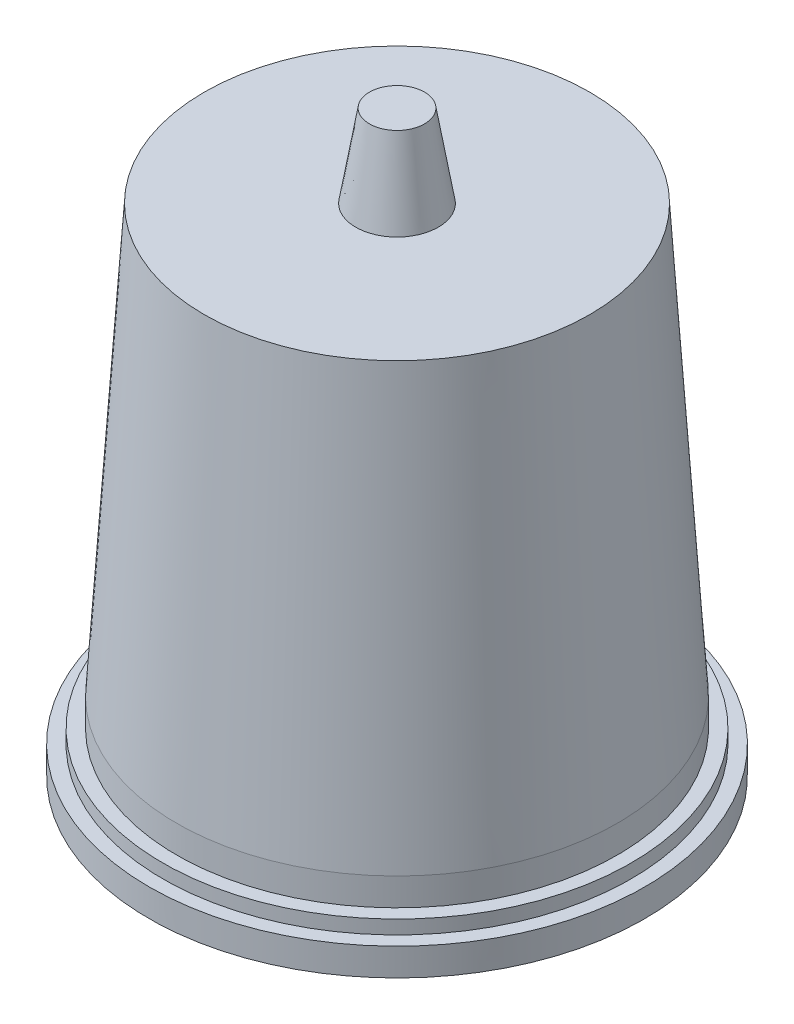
SolidWorks part; units mm, degrees
ref_plane "Alzado" through (0, 0, 0) normal (0, 0, 1) x (1, 0, 0)
ref_plane "Planta" through (0, 0, 0) normal (0, 1, 0) x (1, 0, 0)
ref_plane "Vista lateral" through (0, 0, 0) normal (1, 0, 0) x (0, 0, -1)
sketch "Croquis1" plane through (0, 0, 0) normal (0, 0, 1) x (1, 0, 0)
  line L0 (0, 0) -> (0, 110) construction
  line L1 (0, 5) -> (0, 0)
  line L2 (-45, 5) -> (-45, 10)
  line L4 (-45, 10) -> (-42.5, 10)
  line L5 (-42.5, 10) -> (-42.5, 12.5)
  line L6 (-42.5, 12.5) -> (-40, 12.5)
  line L7 (-40, 12.5) -> (-40, 17.5)
  line L8 (0, 15) -> (0, 5)
  line L10 (0, 110) -> (-5, 110)
  line L11 (0, 110) -> (0, 15)
  line L13 (-7.5, 95) -> (-5, 110)
  line L14 (-7.5, 95) -> (-35, 95)
  line L15 (-35, 95) -> (-40, 17.5)
  arc A0 (-45, 5) -> (0, 0) centre (0, 205) ccw
  point P7 (0, 5)
  point P14 (0, 17.5)
  dimension "D3" = 45
  dimension "D4" = 205
  dimension "D1" = 110
  dimension "D2" = 5
  dimension "D5" = 2.5
  dimension "D6" = 2.5
  dimension "D7" = 2.5
revolve "Revolución1" add sketch "Croquis1" angle 360 about L0
ref_plane "Plano1" through (0, 5, 0) normal (0, 1, 0) x (1, 0, 0)
sketch "Croquis2" plane through (0, 5, 0) normal (0, 1, 0) x (1, 0, 0)
  line L0 (17.4982, 10.68) -> (38.2857, 22.6816)
  line L1 (0, 45) -> (0, 20) construction
  line L2 (-17.3205, 10) -> (-38.9711, 22.5)
  line L3 (17.3205, 10) -> (38.9711, 22.5)
  line L4 (-17.4982, 10.68) -> (-38.2857, 22.6816)
  arc A0 (38.9711, 22.5) -> (-38.9711, 22.5) centre (0, 0) ccw
  circle A1 centre (0, 0) radius 45 construction
  circle A2 centre (0, 0) radius 20
  arc A3 (17.3205, 10) -> (-17.3205, 10) centre (0, 0) ccw
  arc A4 (38.2857, 22.6816) -> (-38.2857, 22.6816) centre (0, 0) ccw
  arc A5 (17.4982, 10.68) -> (-17.4982, 10.68) centre (0, 0) ccw
  dimension "D2" = 0.5
  dimension "D1" = 25
extrude "Cortar-Extruir3" cut sketch "Croquis2" against normal through all
